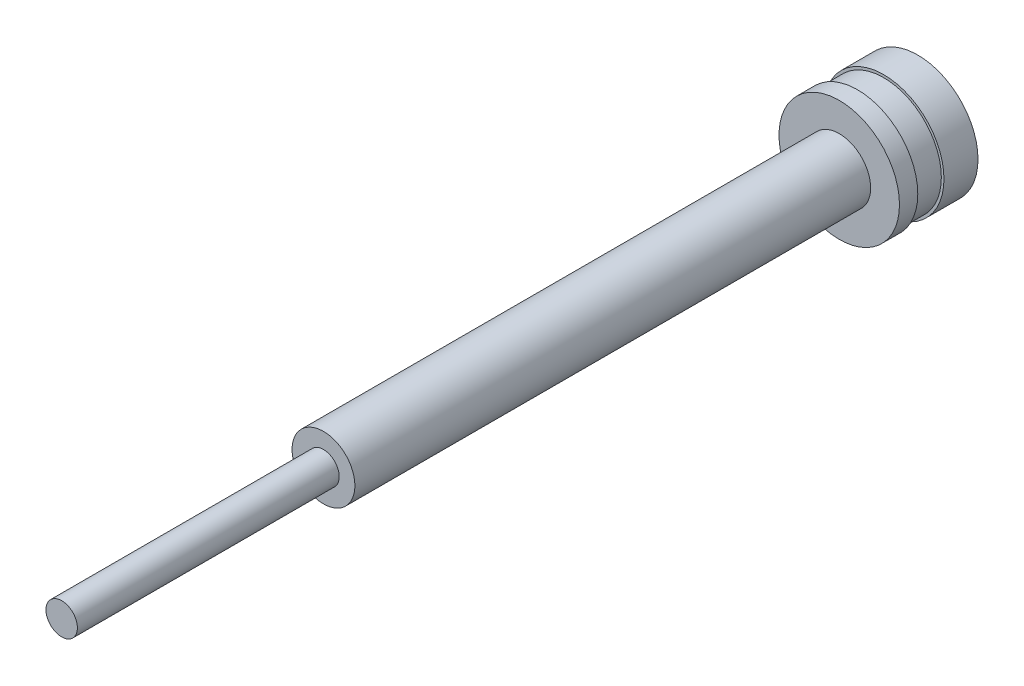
SolidWorks part; units mm, degrees
ref_plane "Plan de face" through (0, 0, 0) normal (0, 0, 1) x (1, 0, 0)
ref_plane "Plan de dessus" through (0, 0, 0) normal (0, 1, 0) x (1, 0, 0)
ref_plane "Plan de droite" through (0, 0, 0) normal (1, 0, 0) x (0, 0, -1)
sketch "Esquisse1" plane through (0, 0, 0) normal (1, 0, 0) x (0, 0, -1)
  line L0 (0, 0) -> (0, 3)
  line L1 (0, 3) -> (50, 3)
  line L2 (50, 3) -> (50, 6)
  line L3 (50, 6) -> (148.5, 6)
  line L4 (148.5, 6) -> (148.5, 11.5)
  line L5 (148.5, 11.5) -> (152, 11.5)
  line L6 (152, 11.5) -> (152, 11)
  line L7 (152, 11) -> (157, 11)
  line L8 (157, 11) -> (157, 11.5)
  line L9 (157, 11.5) -> (163.5, 11.5)
  line L10 (164.5, 0) -> (0, 0)
  line L11 (-41.0721, 0) -> (169.3708, 0) construction
  line L12 (163.5, 11.5) -> (164.5, 6.5)
  line L13 (164.5, 6.5) -> (164.5, 0)
  dimension "D6" = 16
  dimension "D1" = 6
  dimension "D2" = 12
  dimension "D3" = 23
  dimension "D4" = 22
  dimension "D5" = 164.5
  dimension "D7" = 7.5
  dimension "D8" = 5
  dimension "D9" = 1
  dimension "D10" = 50
  dimension "D11" = 5
revolve "Révolution1" add sketch "Esquisse1" angle 360 about L11
